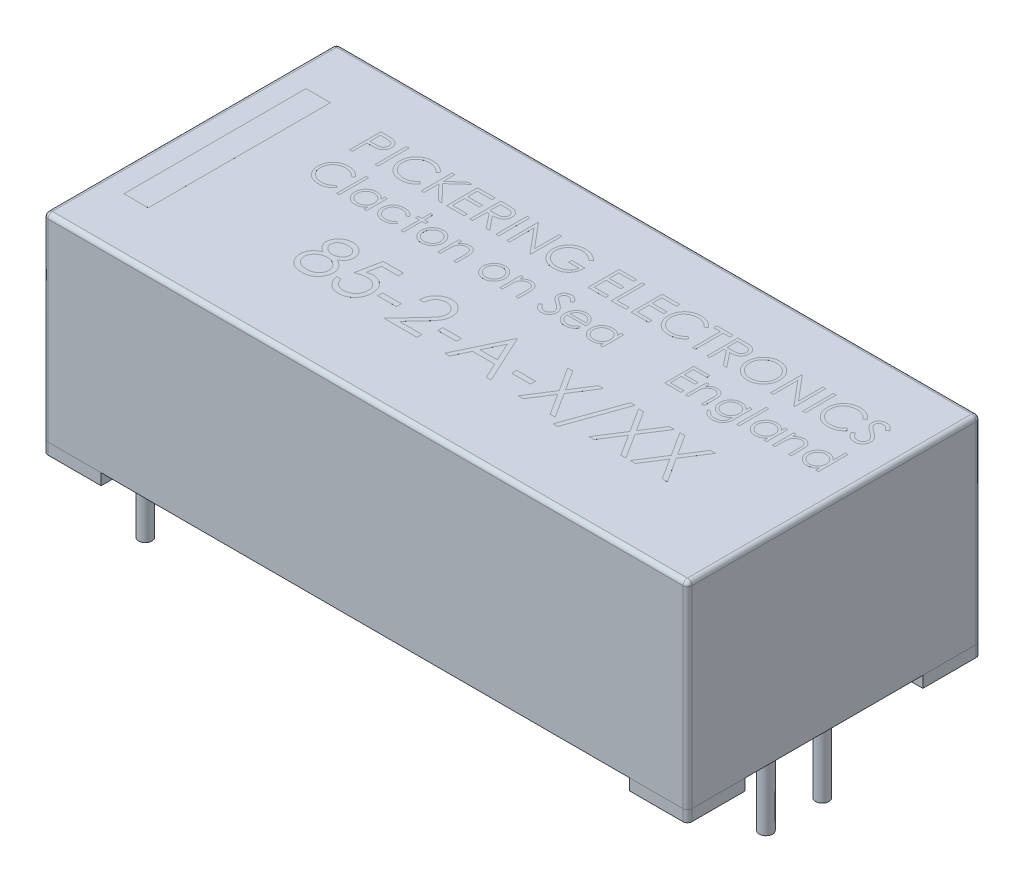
SolidWorks part; units mm, degrees
ref_plane "Front Plane" through (0, 0, 0) normal (0, 0, 1) x (1, 0, 0)
ref_plane "Top Plane" through (0, 0, 0) normal (0, 1, 0) x (1, 0, 0)
ref_plane "Right Plane" through (0, 0, 0) normal (1, 0, 0) x (0, 0, -1)
sketch "Sketch2" plane through (0, 0, 0) normal (0, 1, 0) x (1, 0, 0)
  line L1 (14.5, -6.6) -> (-14.5, -6.6)
  line L2 (14.5, -6.6) -> (14.5, 6.6)
  line L3 (14.5, 6.6) -> (-14.5, 6.6)
  line L4 (-14.5, -6.6) -> (-14.5, 6.6)
  line L5 (14.5, -6.6) -> (-14.5, 6.6) construction
  line L6 (14.5, 6.6) -> (-14.5, -6.6) construction
  point P0 (0, 0)
  dimension "D1" = 13.2
  dimension "D2" = 29
extrude "Main Body" add sketch "Sketch2" along normal blind 8.89 draft 0.023
sketch "Sketch9" plane through (0, 0, 0) normal (0, -1, 0) x (1, 0, 0)
  line L0 (-14.5, -6.6) -> (-14.5, 6.6) construction
  line L2 (14.5, -6.6) -> (-14.5, -6.6) construction
  circle A0 centre (-12.7, -3.81) radius 0.3
  circle A1 centre (-12.7, -1.27) radius 0.2963
  circle A2 centre (-12.7, 1.27) radius 0.3
  circle A3 centre (-12.7, 3.81) radius 0.3
  dimension "D1" = 0.6
  dimension "D5" = 0.6
  dimension "D7" = 0.6
  dimension "D2" = 5.33
  dimension "D3" = 1.8
  dimension "D6" = 2.54
  dimension "D8" = 2.54
extrude "Left hand Pins" add sketch "Sketch9" along normal blind 4.31
sketch "Sketch10" plane through (0, 0, 0) normal (0, -1, 0) x (1, 0, 0)
  line L1 (14.5, 6.6) -> (11.9, 6.6)
  line L2 (14.5, 6.6) -> (14.5, 4)
  line L3 (14.5, 4) -> (11.9, 4)
  line L4 (11.9, 6.6) -> (11.9, 4)
  dimension "D1" = 2.6
  dimension "D2" = 2.6
extrude "Foot" add sketch "Sketch10" along normal blind 0.51
sketch "Sketch11" plane through (0, -0.51, 0) normal (0, -1, 0) x (1, 0, 0)
  line L0 (14.5, 6.6) -> (11.9, 6.6) construction
  line L1 (11.9, 4) -> (13.95, 4)
  line L2 (11.9, 4) -> (11.9, 6.05)
  line L3 (11.9, 6.05) -> (13.95, 6.05)
  line L4 (13.95, 4) -> (13.95, 6.05)
  line L5 (14.5, 4) -> (14.5, 6.6) construction
  dimension "D1" = 0.55
  dimension "D2" = 0.55
extrude "foot cut" cut sketch "Sketch11" against normal up to surface (0.51 mm away)
mirror "Mirror3" about plane through (0, 0, 0) normal (0, 0, 1) of "foot cut", "Foot"
mirror "Mirror4" about plane through (0, 0, 0) normal (1, 0, 0) of "Mirror3", "Foot", "foot cut"
sketch "Sketch12"
  dimension "D1" = 1.1
  dimension "D2" = 8.2
  dimension "D3" = 2.4965
  dimension "D4" = 1.4
  dimension "D5" = 2
  dimension "D6" = 3.8
extrude "Lettering" add sketch "Sketch12" along normal blind 0.0001
sketch "Sketch13"
  dimension "D1" = 0.6
  dimension "D2" = 0.6
  dimension "D3" = 2.54
  dimension "D4" = 5.33
  dimension "D5" = 1.8
extrude "Right hand pins" add sketch "Sketch13" along normal blind 4.31
fillet "Fillet1" radius 0.2 12 edges at (14.5, -0.255, -6.6) (-14.5, -0.255, -6.6) (14.5, -0.255, 6.6) (-14.5, -0.255, 6.6) (14.4983, 4.445, -6.5983) (-14.4983, 4.445, -6.5983) (-14.4965, 8.89, 0) (0, 8.89, -6.5965) (14.4965, 8.89, 0) (14.4983, 4.445, 6.5983) (-14.4983, 4.445, 6.5983) (0, 8.89, 6.5965)
